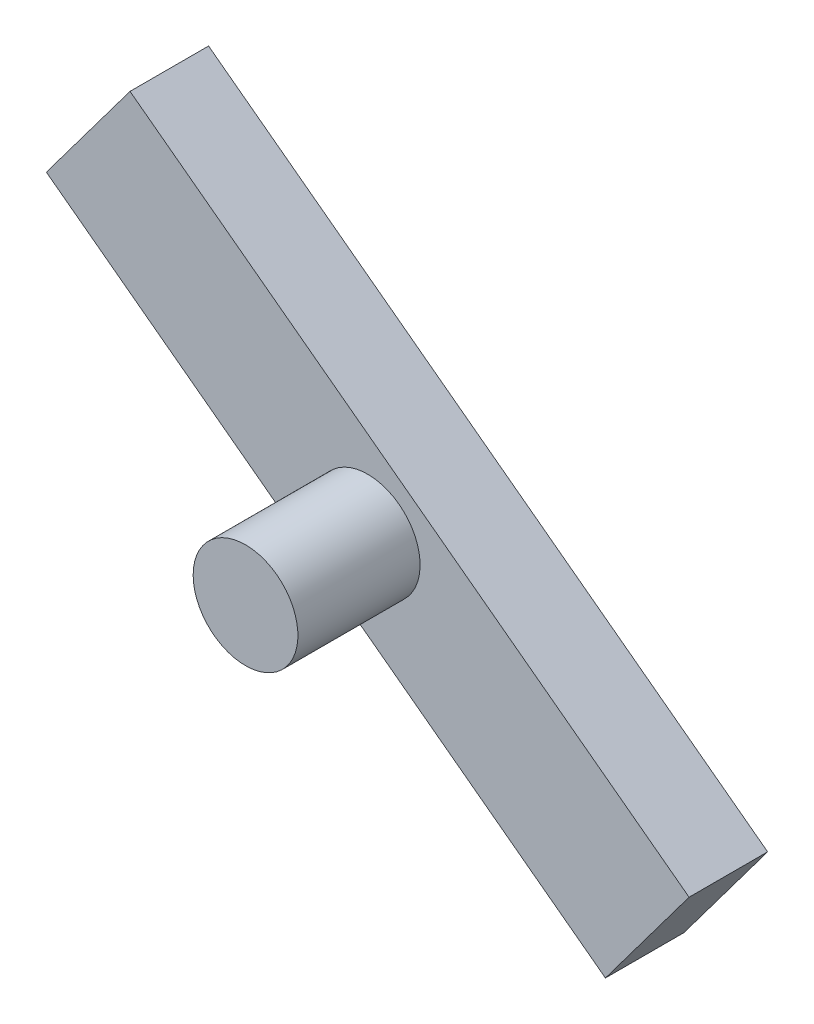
SolidWorks part; units mm, degrees
ref_plane "Alzado" through (0, 0, 0) normal (0, 0, 1) x (1, 0, 0)
ref_plane "Planta" through (0, 0, 0) normal (0, 1, 0) x (1, 0, 0)
ref_plane "Vista lateral" through (0, 0, 0) normal (1, 0, 0) x (0, 0, -1)
sketch3d "Sk_Vastago"
  line L0 (-263.1284, 316.5049, 22) -> (-263.1284, 316.5049, 15)
sweep "Vastago" add path "Sk_Vastago" parameters "D3"=6
sketch "Sk_Goma" plane through (0, 0, 0) normal (0, 0, 1) x (1, 0, 0)
  line L0 (-249.5118, 301.3198) -> (-244.7188, 307.725)
  line L1 (-244.7188, 307.725) -> (-276.7449, 331.6901)
  line L2 (-276.7449, 331.6901) -> (-281.538, 325.2848)
  line L3 (-281.538, 325.2848) -> (-249.5118, 301.3198)
extrude "Goma" add sketch "Sk_Goma" along normal blind 4.5 from offset 10.5
